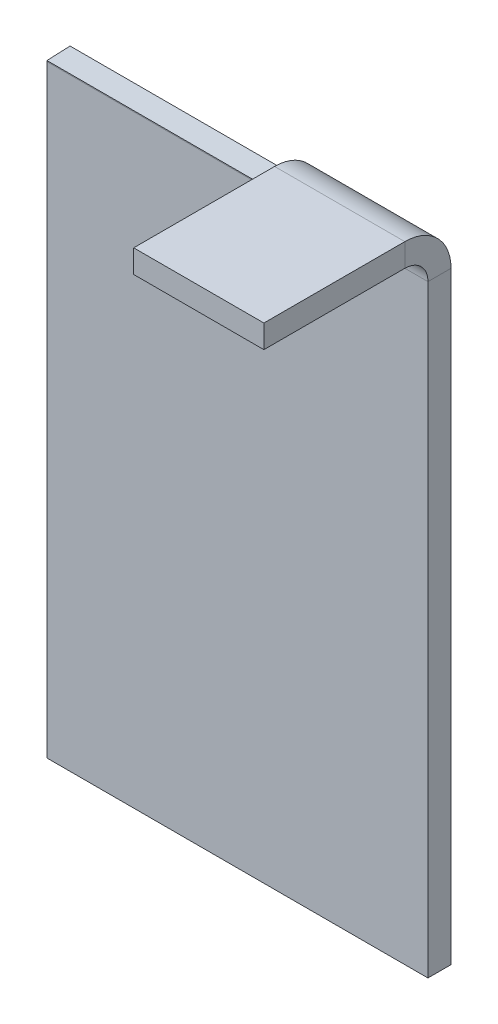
SolidWorks part; units mm, degrees
ref_plane "Ebene vorne" through (0, 0, 0) normal (0, 0, 1) x (1, 0, 0)
ref_plane "Ebene oben" through (0, 0, 0) normal (0, 1, 0) x (1, 0, 0)
ref_plane "Ebene rechts" through (0, 0, 0) normal (1, 0, 0) x (0, 0, -1)
sketch "Skizze1" plane through (0, 0, 0) normal (0, 0, 1) x (1, 0, 0)
  line L0 (7.8261, 39.2569) -> (7.8261, 63.745)
  line L1 (-24.7407, 39.2569) -> (7.8261, 39.2569)
  line L2 (-24.7407, 39.2569) -> (-24.7407, -39.2569)
  line L3 (-24.7407, -39.2569) -> (24.7407, -39.2569)
  line L4 (24.7407, 63.745) -> (24.7407, -39.2569)
  line L7 (7.8261, 63.745) -> (24.7407, 63.745)
  point P0 (0, 0)
sheet metal parameters "Blech1" thickness 3 parameters "D1"=3, "Dicke"=3
base flange "Basis-Blech1" sketch "Skizze1" thickness 3 reverse thickness direction yes parameters "D1"=3
sketch "Skizze3" plane through (0, 0, 3) normal (0, 0, 1) x (1, 0, 0)
  line L1 (24.7407, -39.2569) -> (24.7407, 63.745) construction
  line L2 (7.8261, 42.2569) -> (24.7407, 42.2569)
  line L3 (7.8261, 63.745) -> (7.8261, 39.2569) construction
  line L4 (-24.7407, 39.2569) -> (7.8261, 39.2569) construction
  dimension "D1" = 3
sketched bend "Skizzierte Biegung1" parameters "D1"=3
bend "Skizzenbiegung2" bend radius 3 bend angle 90 parameters "D5"=1
flat pattern "Abwicklung1"
sketch "Biegung-Linien1" plane through (0, 0, 0) normal (0, 1, 0) x (-1, 0, 0)
bend of the flat pattern "Abwickeln-<Skizzenbiegung2>1"
